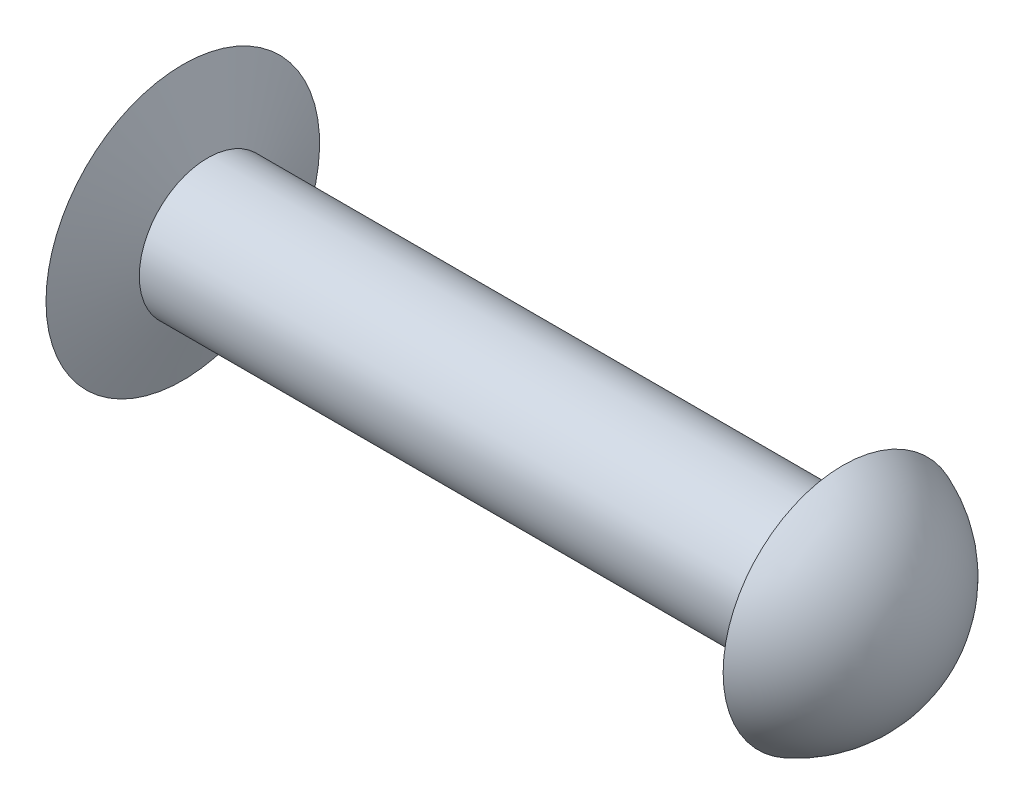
SolidWorks part; units mm, degrees
ref_plane "Plane1" through (0, 0, 0) normal (0, 0, 1) x (1, 0, 0)
ref_plane "Plane2" through (0, 0, 0) normal (0, 1, 0) x (1, 0, 0)
ref_plane "Plane3" through (0, 0, 0) normal (1, 0, 0) x (0, 0, -1)
sketch "Sketch1" plane through (0, 0, 0) normal (0, 0, 1) x (1, 0, 0)
  line L0 (-39, 0) -> (6, 0) construction
  line L1 (-30.9508, 0) -> (0, 0)
  line L2 (-27.8589, 3) -> (-28.9508, 6)
  line L3 (-27.8589, 3) -> (0, 3)
  line L4 (0, 3) -> (0, 0)
  line L5 (-27.8589, -3) -> (-28.9508, -6) construction
  arc A0 (-28.9508, 6) -> (-30.9508, 0) centre (-20.9508, 0) ccw
  point P12 (-27.8589, 3)
  dimension "HeadRadius" = 10
  dimension "D1" = 140
  dimension "Diameter" = 6
  dimension "GripLength" = 28.9508
  dimension "HeadDia" = 12
revolve "Base-Revolve" add sketch "Sketch1" angle 360 about L0
sketch "Sketch2" plane through (0, 0, 0) normal (0, 0, 1) x (1, 0, 0)
  line L0 (-49, 0) -> (29, 0) construction
  line L1 (0, 0) -> (3.6, 0)
  line L2 (0, 0) -> (0, 5.25)
  arc A0 (3.6, 0) -> (0, 5.25) centre (-2.0281, 0) ccw
  dimension "HeadDiaA" = 10.5
  dimension "HeadHtA" = 3.6
revolve "HeadTypeA" add sketch "Sketch2" angle 360 about L0
sketch "Sketch3" plane through (0, 0, 0) normal (0, 0, 1) x (1, 0, 0)
  line L0 (30, 0) -> (-54, 0) construction
  line L1 (-39, 0) -> (6, 0) construction
  line L2 (0, 0) -> (0, 5.25)
  line L3 (0, 5.25) -> (-2.9323, 3)
  line L4 (-2.9323, 0) -> (0, 0)
  line L5 (0, -5.25) -> (-2.9323, -3) construction
  line L6 (-2.9323, 0) -> (-2.9323, 3)
  dimension "HeadDiaB" = 10.5
  dimension "D2" = 75
  dimension "D3" = 6
revolve "HeadTypeB" [suppressed] add sketch "Sketch3" angle 360 about L0
equation "\"D3@Sketch3\" = \"Diameter@Sketch1\""
